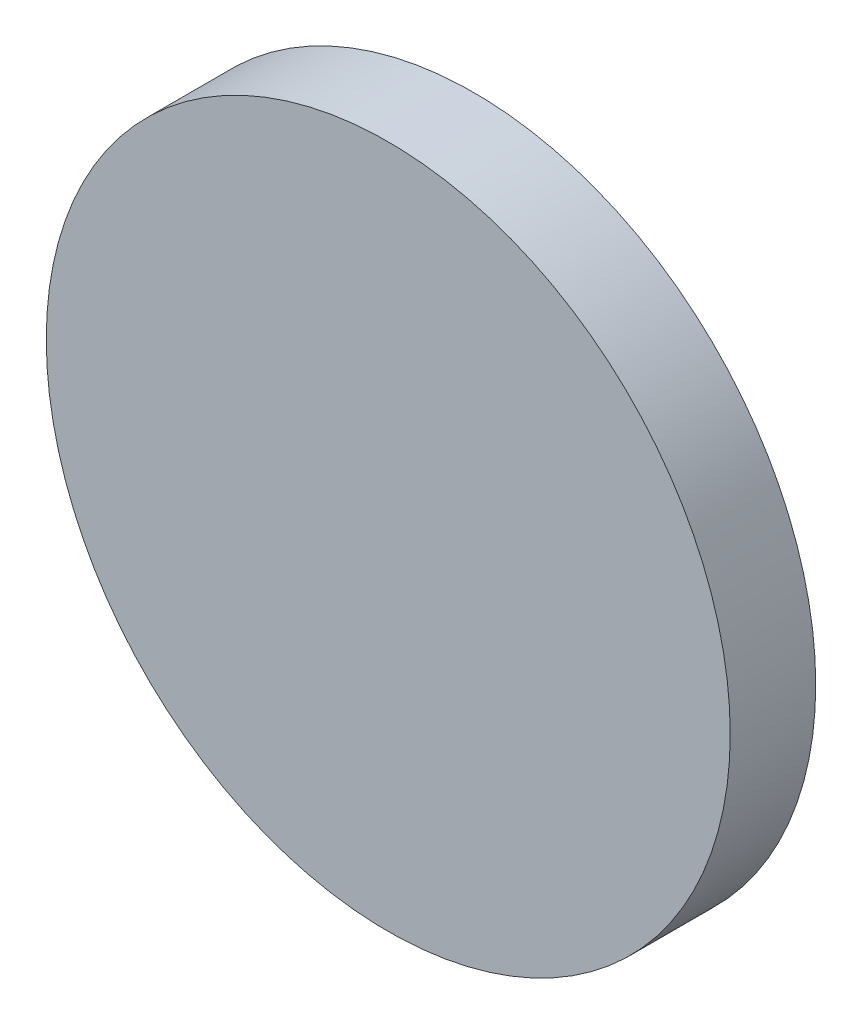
SolidWorks part; units mm, degrees
ref_plane "Face" through (0, 0, 0) normal (0, 0, 1) x (1, 0, 0)
ref_plane "Dessus" through (0, 0, 0) normal (0, 1, 0) x (1, 0, 0)
ref_plane "Droite" through (0, 0, 0) normal (1, 0, 0) x (0, 0, -1)
sketch "Esquisse1" plane through (0, 0, 0) normal (0, 0, 1) x (1, 0, 0)
  circle A0 centre (0, 0) radius 20
  dimension "D1" = 40
extrude "Base-Extrusion" add sketch "Esquisse1" along normal blind 5
